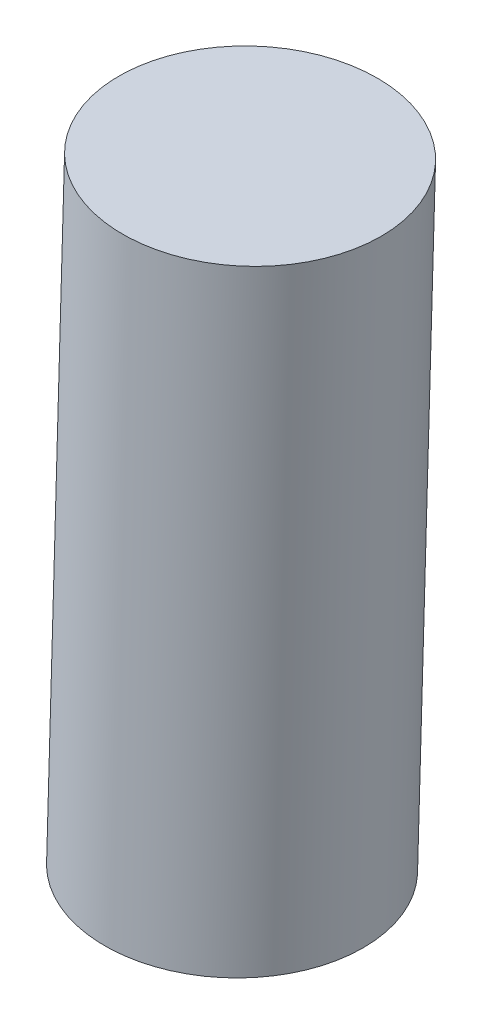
SolidWorks part; units mm, degrees
ref_plane "Plan de face" through (0, 0, 0) normal (0, 0, 1) x (1, 0, 0)
ref_plane "Plan de dessus" through (0, 0, 0) normal (0, 1, 0) x (1, 0, 0)
ref_plane "Plan de droite" through (0, 0, 0) normal (1, 0, 0) x (0, 0, -1)
ref_plane "Plan4" through (0, 0, -92.9921) normal (0, 0, 1) x (1, 0, 0)
sketch "Esquisse1" plane through (0, 0, -92.9921) normal (0, 0, 1) x (1, 0, 0)
  line L0 (-217.2232, -5.388) -> (-224.2203, -5.1866)
  line L1 (-224.2203, -5.1866) -> (-225.1803, -38.5381)
  line L2 (-225.1803, -38.5381) -> (-218.1832, -38.7395)
  line L3 (-218.1832, -38.7395) -> (-217.2232, -5.388)
  line L4 (-224.2145, -4.9854) -> (-225.1861, -38.7393) construction
revolve "Révolution1" add sketch "Esquisse1" angle 360 about L4
